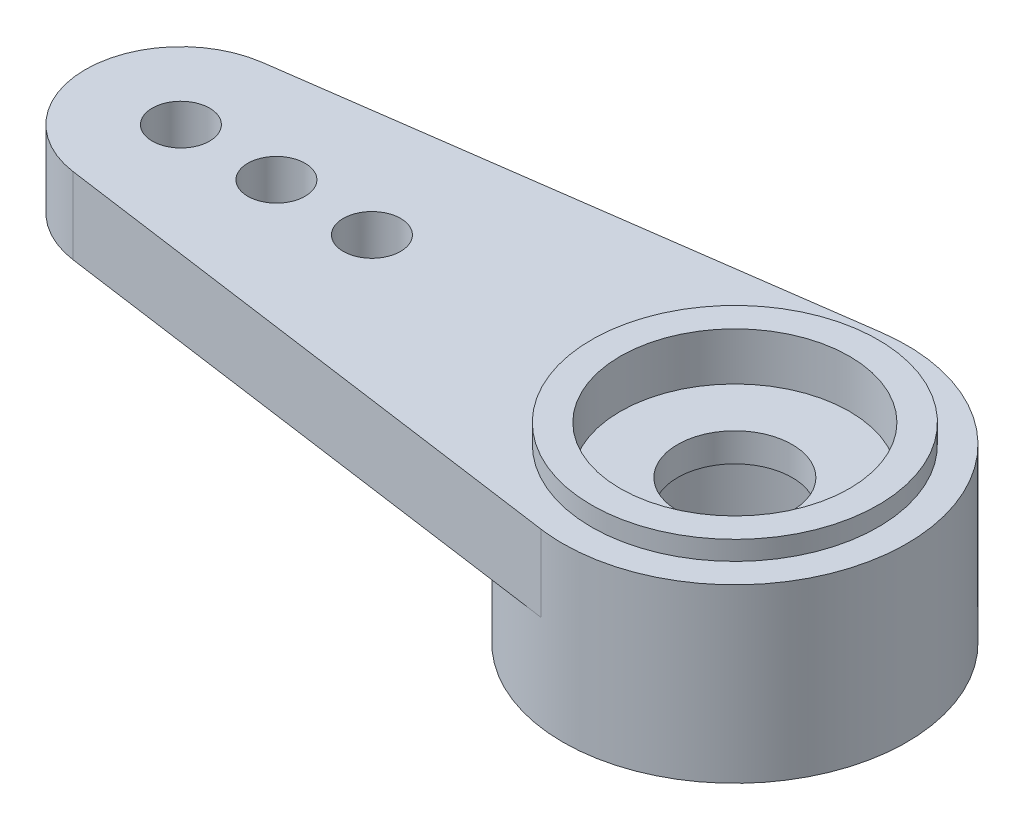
SolidWorks part; units mm, degrees
ref_plane "Přední" through (0, 0, 0) normal (0, 0, 1) x (1, 0, 0)
ref_plane "Horní" through (0, 0, 0) normal (0, 1, 0) x (1, 0, 0)
ref_plane "Pravá" through (0, 0, 0) normal (1, 0, 0) x (0, 0, -1)
sketch "Skica1" plane through (0, 0, 0) normal (0, 0, 1) x (1, 0, 0)
  line L0 (0, 9.5609) -> (0, -3.8281) construction
  line L1 (3, 0) -> (4.5, 0)
  line L2 (4.5, 0) -> (4.5, 2.5)
  line L3 (4.5, 2.5) -> (17, 2.5)
  line L4 (17, 2.5) -> (17, 4.5)
  line L5 (17, 4.5) -> (3.75, 4.5)
  line L6 (3.75, 4.5) -> (3.75, 5)
  line L7 (3.75, 5) -> (3, 5)
  line L8 (3, 5) -> (3, 3.75)
  line L9 (3, 3.75) -> (1.5, 3.75)
  line L10 (1.5, 3.75) -> (1.5, 3)
  line L11 (1.5, 3) -> (3, 3)
  line L12 (3, 3) -> (3, 0)
  dimension "D1" = 3
  dimension "D2" = 6
  dimension "D3" = 6
  dimension "D4" = 9
  dimension "D5" = 7.5
  dimension "D6" = 34
  dimension "D7" = 2
  dimension "D8" = 1.25
  dimension "D9" = 5
  dimension "D10" = 4.5
  dimension "D11" = 3
revolve "Základ-Rotační" add sketch "Skica1" angle 360 about L0
sketch "Skica2" plane through (0, 4.5, 0) normal (0, 1, 0) x (-1, 0, 0)
  line L0 (-10.5955, 0) -> (18.7121, 0) construction
  line L1 (0, -10.1252) -> (0, 9.0359) construction
  circle A0 centre (-9.5, 0) radius 0.75
  circle A1 centre (9.5, 0) radius 0.75
  circle A2 centre (12, 0) radius 0.75
  circle A3 centre (14.5, 0) radius 0.75
  circle A4 centre (-14.5, 0) radius 0.75
  circle A5 centre (-12, 0) radius 0.75
  dimension "D1" = 19
  dimension "D2" = 1.5
  dimension "D3" = 24
  dimension "D4" = 29
extrude "Odebrat vysunutím1" cut sketch "Skica2" against normal through all
sketch "Skica3" plane through (0, 4.5, 0) normal (0, 1, 0) x (-1, 0, 0)
  line L0 (-17.8303, 0) -> (18.095, 0) construction
  line L1 (0, -9.9903) -> (0, 8.9317) construction
  line L2 (-14.8448, -2.4761) -> (-0.6207, -4.457)
  line L3 (-14.8448, 2.4761) -> (-0.6207, 4.457)
  line L4 (14.8448, 2.4761) -> (0.6207, 4.457)
  line L5 (14.8448, -2.4761) -> (0.6207, -4.457)
  arc A0 (-14.8448, 2.4761) -> (-14.8448, -2.4761) centre (-14.5, 0) ccw
  arc A1 (-0.6207, -4.457) -> (0.6207, -4.457) centre (0, 0) ccw
  arc A2 (14.8448, 2.4761) -> (14.8448, -2.4761) centre (14.5, 0) cw
  arc A3 (0.6207, 4.457) -> (-0.6207, 4.457) centre (0, 0) ccw
  dimension "D1" = 2.5
  dimension "D2" = 9
extrude "Odebrat vysunutím2" cut sketch "Skica3" against normal through all flip side to cut
sketch "Skica4" plane through (0, 2.5, 0) normal (0, -1, 0) x (1, 0, 0)
  arc A0 (0.6207, -4.457) -> (0.6207, 4.457) centre (0, 0) ccw construction
  arc A1 (0.6207, -4.457) -> (0.6207, 4.457) centre (0, 0) ccw
extrude "Odebrat vysunutím3" cut sketch "Skica4" against normal through all and the other way through all flip side to cut
